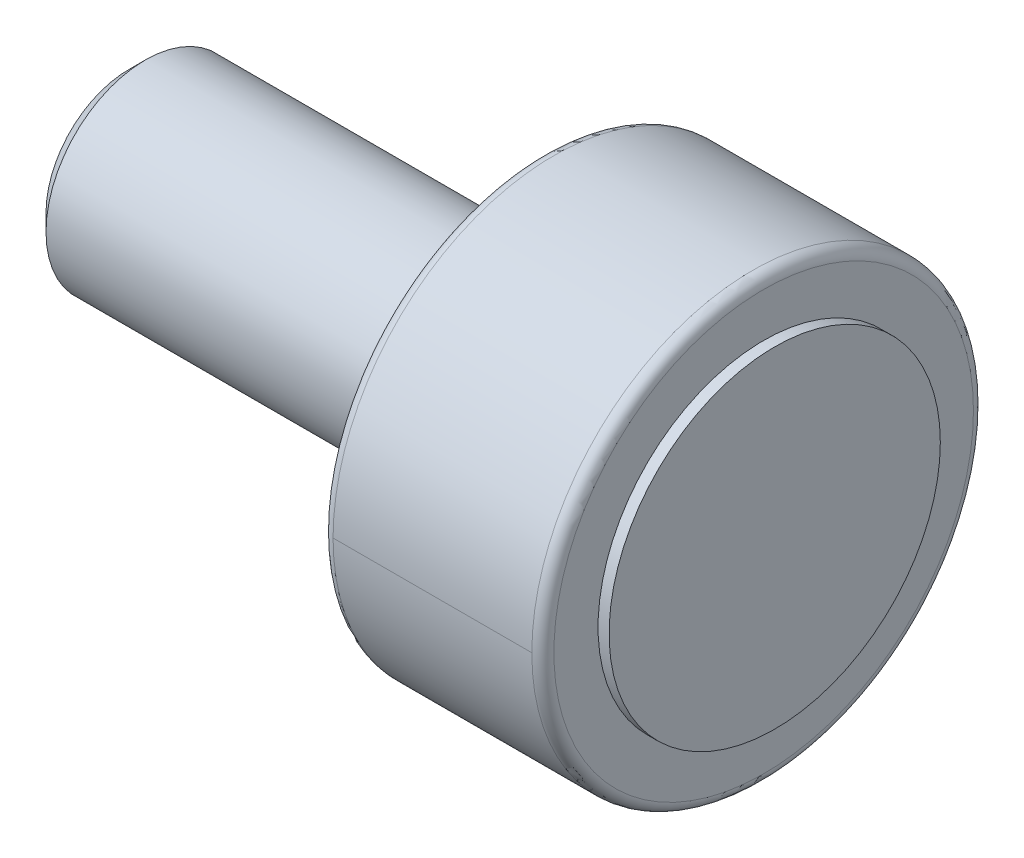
SolidWorks part; units mm, degrees
ref_plane "Face" through (0, 0, 0) normal (0, 0, 1) x (1, 0, 0)
ref_plane "Dessus" through (0, 0, 0) normal (0, 1, 0) x (1, 0, 0)
ref_plane "Droite" through (0, 0, 0) normal (1, 0, 0) x (0, 0, -1)
sketch "Esquisse1" plane through (0, 0, 0) normal (0, 0, 1) x (1, 0, 0)
  line L0 (0, 0) -> (-69.4503, 0) construction
  line L1 (-58.5, 0) -> (-58.5, 9)
  line L2 (-58.5, 9) -> (-22, 9)
  line L3 (-22, 9) -> (-22, 15)
  line L4 (-22, 15) -> (-21, 15)
  line L5 (-21, 15) -> (-21, 20)
  line L6 (-21, 20) -> (-1, 20)
  line L7 (-1, 20) -> (-1, 15)
  line L8 (-1, 15) -> (0, 15)
  line L9 (0, 15) -> (0, 0)
  line L10 (0, 0) -> (-58.5, 0)
  dimension "D1" = 36.5
  dimension "D2" = 1
  dimension "D3" = 1
  dimension "D4" = 20
  dimension "D5" = 20
  dimension "D6" = 15
  dimension "D7" = 18
revolve "Révolution1" add sketch "Esquisse1" angle 360 about L0
fillet "Congé1" radius 1 2 edges at (-21, 0, -20) (-1, 0, -20)
chamfer "Chanfrein1" distance 1.5 angle 45 1 edges at (-58.5, 0, -9)
sketch "Esquisse2" plane through (0, 0, 0) normal (0, 0, 1) x (1, 0, 0)
  line L0 (0, 0) -> (-20, 0)
  line L1 (-20, -20) -> (-20, 20) construction
